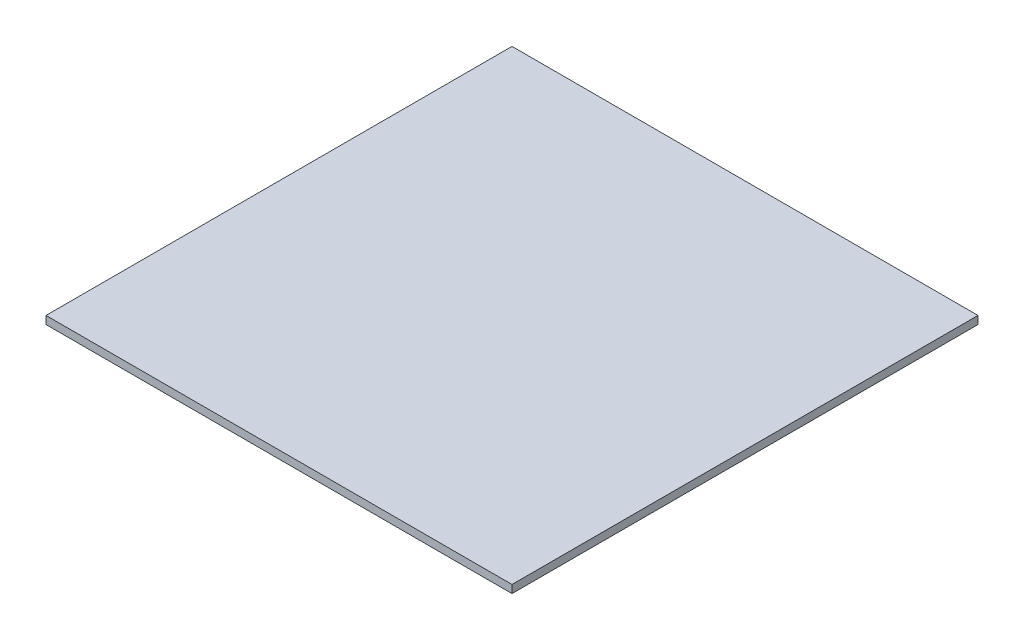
SolidWorks part; units mm, degrees
ref_plane "Front Plane" through (0, 0, 0) normal (0, 0, 1) x (1, 0, 0)
ref_plane "Top Plane" through (0, 0, 0) normal (0, 1, 0) x (1, 0, 0)
ref_plane "Right Plane" through (0, 0, 0) normal (1, 0, 0) x (0, 0, -1)
sketch "Sketch1" plane through (0, 0, 0) normal (0, 1, 0) x (1, 0, 0)
  line L1 (-5, 5) -> (5, 5)
  line L2 (-5, 5) -> (-5, -5)
  line L3 (-5, -5) -> (5, -5)
  line L4 (5, 5) -> (5, -5)
  line L5 (-5, 5) -> (5, -5) construction
  line L6 (-5, -5) -> (5, 5) construction
  point P0 (0, 0)
  dimension "D1" = 10
  dimension "D2" = 10
extrude "Boss-Extrude1" add sketch "Sketch1" along normal blind 0.17
